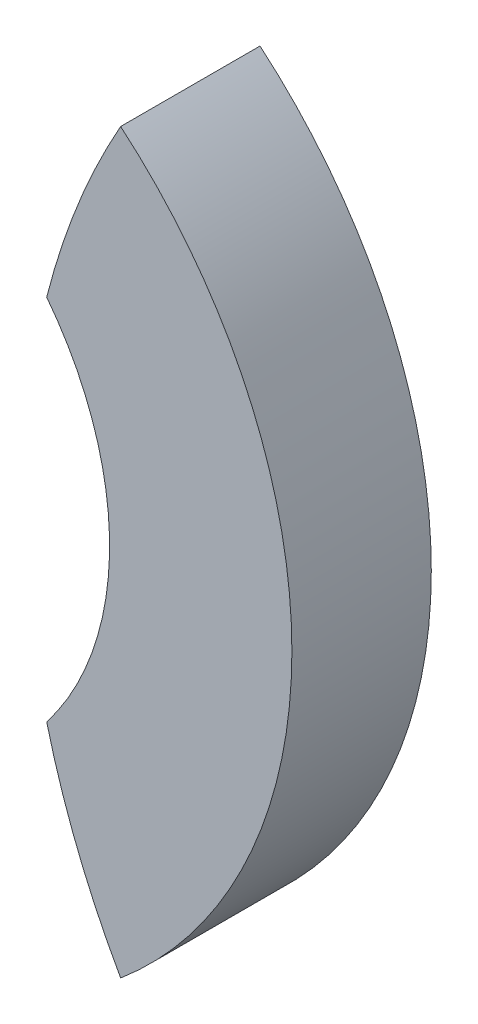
SolidWorks part; units mm, degrees
ref_plane "Plan1" through (0, 0, 0) normal (0, 0, 1) x (1, 0, 0)
ref_plane "Plan2" through (0, 0, 0) normal (0, 1, 0) x (1, 0, 0)
ref_plane "Plan3" through (0, 0, 0) normal (1, 0, 0) x (0, 0, -1)
sketch "Esquisse1" plane through (0, 0, 0) normal (0, 0, 1) x (1, 0, 0)
  arc A0 (14.5139, -17.1929) -> (14.5139, 17.1929) centre (0, 0) ccw
  arc A1 (11.0667, -8.5749) -> (11.0667, 8.5749) centre (0, 0) ccw
  arc A2 (14.5139, 17.1929) -> (11.0667, 8.5749) centre (45, 0) ccw
  arc A3 (11.0667, -8.5749) -> (14.5139, -17.1929) centre (45, 0) ccw
  dimension "D1" = 28
  dimension "D2" = 45
  dimension "D3" = 70
  dimension "D4" = 45
extrude "Base-Extrusion" add sketch "Esquisse1" along normal blind 6.5
